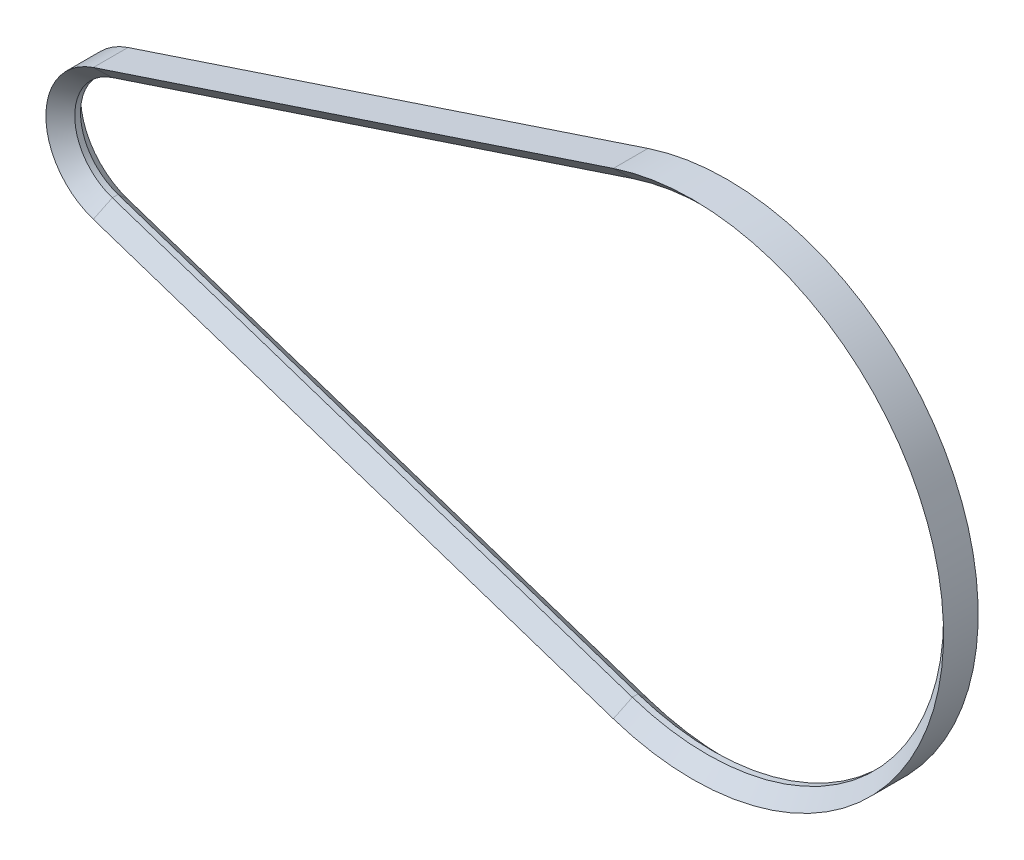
SolidWorks part; units mm, degrees
ref_plane "Face" through (0, 0, 0) normal (0, 0, 1) x (1, 0, 0)
ref_plane "Dessus" through (0, 0, 0) normal (0, 1, 0) x (1, 0, 0)
ref_plane "Droite" through (0, 0, 0) normal (1, 0, 0) x (0, 0, -1)
sketch "Esquisse1" plane through (0, 0, 0) normal (0, 0, 1) x (1, 0, 0)
  line L0 (86.6125, 40.3364) -> (-3.465, 10.44)
  line L1 (100, 0) -> (0, 0) construction
  line L2 (86.6125, -40.3364) -> (-3.465, -10.44)
  arc A0 (-3.465, 10.44) -> (-3.465, -10.44) centre (0, 0) ccw
  arc A1 (86.6125, -40.3364) -> (86.6125, 40.3364) centre (100, 0) ccw
  dimension "D2" = 11
  dimension "D3" = 42.5
  dimension "D1" = 100
sketch "Esquisse2" plane through (0, 0, 0) normal (0, 1, 0) x (1, 0, 0)
  line L0 (0, 0) -> (-35.5281, 0) construction
  line L1 (-12, -3) -> (-12, 3)
  line L2 (-12, 3) -> (-9.5, 0.5)
  line L3 (-12, -3) -> (-9.5, -0.5)
  line L4 (-9.5, 0.5) -> (-9.5, -0.5)
  point P6 (-12, 0)
  point P9 (-9.5, 0)
  dimension "D1" = 45
  dimension "D2" = 6
  dimension "D3" = 2.5
  dimension "D4" = 9.5
sweep "Balayage1" add profiles "Esquisse2" path "Esquisse1"
